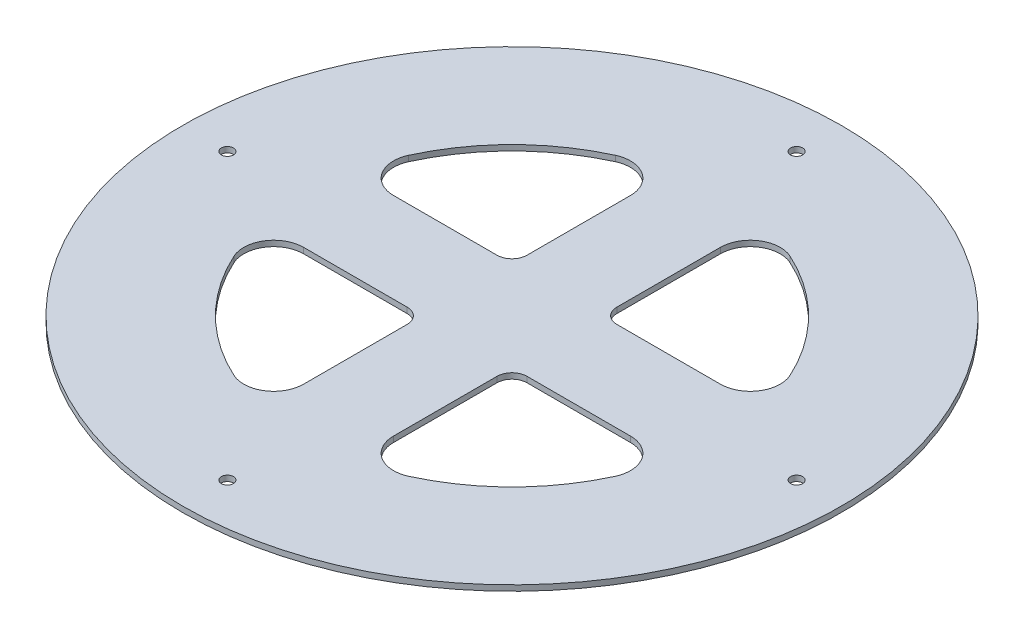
SolidWorks part; units mm, degrees
ref_plane "Front Plane" through (0, 0, 0) normal (0, 0, 1) x (1, 0, 0)
ref_plane "Top Plane" through (0, 0, 0) normal (0, 1, 0) x (1, 0, 0)
ref_plane "Right Plane" through (0, 0, 0) normal (1, 0, 0) x (0, 0, -1)
sketch "Sketch1" plane through (0, 0, 0) normal (0, 1, 0) x (1, 0, 0)
  line L0 (-76.2, 277.0813) -> (-76.2, 101.6)
  line L1 (76.2, 277.0813) -> (76.2, 101.6)
  line L2 (-277.0813, -76.2) -> (-101.6, -76.2)
  line L3 (-277.0813, 76.2) -> (-101.6, 76.2)
  line L4 (-76.2, -101.6) -> (-76.2, -277.0813)
  line L5 (101.6, 76.2) -> (277.0813, 76.2)
  line L6 (76.2, -101.6) -> (76.2, -277.0813)
  line L7 (101.6, -76.2) -> (277.0813, -76.2)
  circle A0 centre (0, 0) radius 558.8
  arc A1 (-148.1667, 323.2615) -> (-323.2615, 148.1667) centre (0, 0) ccw
  arc A2 (-323.2615, -148.1667) -> (-148.1667, -323.2615) centre (0, 0) ccw
  arc A3 (148.1667, -323.2615) -> (323.2615, -148.1667) centre (0, 0) ccw
  arc A4 (323.2615, 148.1667) -> (148.1667, 323.2615) centre (0, 0) ccw
  arc A5 (-148.1667, 323.2615) -> (-76.2, 277.0813) centre (-127, 277.0813) cw
  arc A6 (-277.0813, 76.2) -> (-323.2615, 148.1667) centre (-277.0813, 127) cw
  arc A7 (76.2, 277.0813) -> (148.1667, 323.2615) centre (127, 277.0813) cw
  arc A8 (277.0813, 76.2) -> (323.2615, 148.1667) centre (277.0813, 127) ccw
  arc A9 (323.2615, -148.1667) -> (277.0813, -76.2) centre (277.0813, -127) ccw
  arc A10 (76.2, -277.0813) -> (148.1667, -323.2615) centre (127, -277.0813) ccw
  arc A11 (-148.1667, -323.2615) -> (-76.2, -277.0813) centre (-127, -277.0813) ccw
  arc A12 (-277.0813, -76.2) -> (-323.2615, -148.1667) centre (-277.0813, -127) ccw
  arc A13 (-101.6, 76.2) -> (-76.2, 101.6) centre (-101.6, 101.6) ccw
  arc A14 (101.6, 76.2) -> (76.2, 101.6) centre (101.6, 101.6) cw
  arc A15 (76.2, -101.6) -> (101.6, -76.2) centre (101.6, -101.6) cw
  arc A16 (-76.2, -101.6) -> (-101.6, -76.2) centre (-101.6, -101.6) ccw
  point P23 (347.3398, 76.2)
  point P26 (347.3398, -76.2)
  point P29 (76.2, -347.3398)
  point P32 (-76.2, -347.3398)
  point P35 (-347.3398, -76.2)
  point P42 (76.2, -76.2)
  dimension "D1" = 1117.6
  dimension "D2" = 76.2
  dimension "D6" = 50.8
  dimension "D7" = 50.8
  dimension "D8" = 50.8
  dimension "D9" = 50.8
  dimension "D10" = 50.8
  dimension "D11" = 25.4
  dimension "D3" = 76.2
  dimension "D4" = 76.2
  dimension "D5" = 76.2
extrude "Extrude1" add sketch "Sketch1" against normal blind 9.525
sketch "Sketch3" plane through (0, 0, 0) normal (0, 1, 0) x (-1, 0, 0)
  circle A0 centre (0, -482.6) radius 10.3124
  dimension "D1" = 482.6
extrude "Cut-Extrude1" cut sketch "Sketch3" against normal through all
pattern_circular "CirPattern1" count 4 over 360 about axis through (0, 0, 0) along (0, 1, 0) of "Cut-Extrude1"
